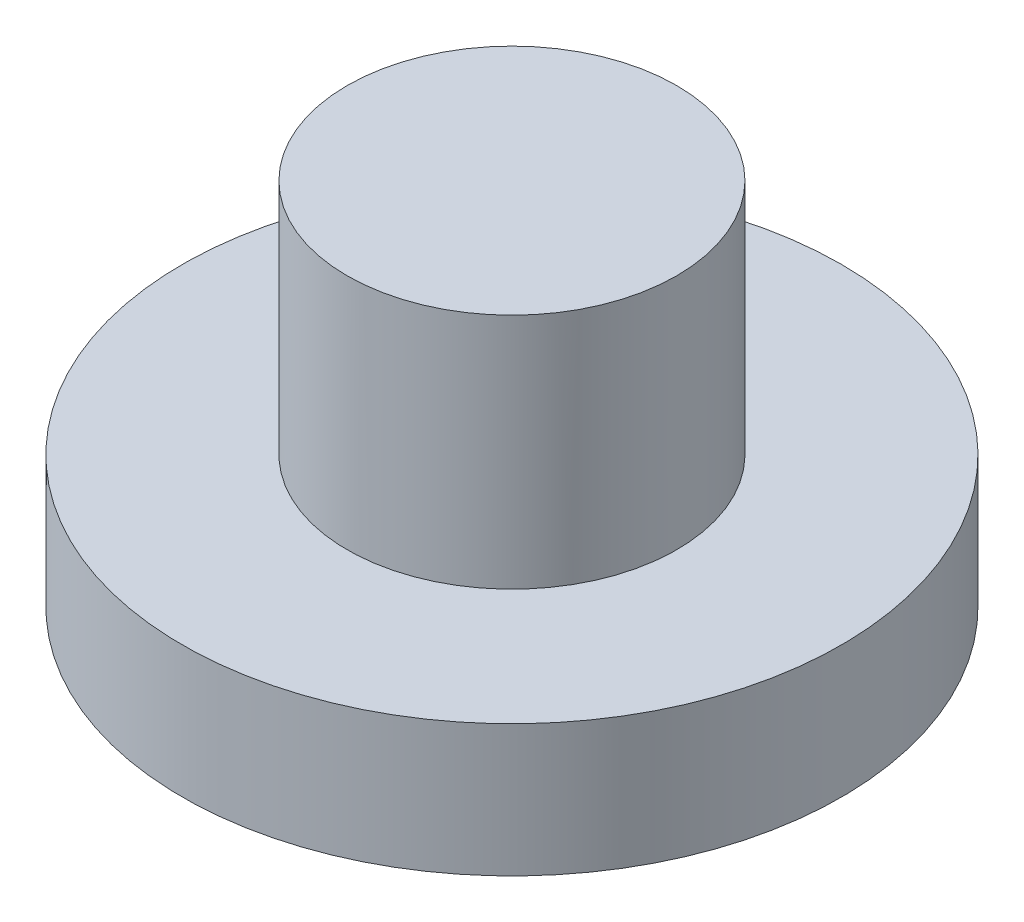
SolidWorks part; units mm, degrees
ref_plane "Front Plane" through (0, 0, 0) normal (0, 0, 1) x (1, 0, 0)
ref_plane "Top Plane" through (0, 0, 0) normal (0, 1, 0) x (1, 0, 0)
ref_plane "Right Plane" through (0, 0, 0) normal (1, 0, 0) x (0, 0, -1)
sketch "Sketch1" plane through (0, 0, 0) normal (0, 1, 0) x (1, 0, 0)
  circle A0 centre (0, 0) radius 0.7938
  dimension "D1" = 1.5875
extrude "Boss-Extrude1" add sketch "Sketch1" along normal blind 1.143
sketch "Sketch2" plane through (0, 0, 0) normal (0, -1, 0) x (1, 0, 0)
  circle A0 centre (0, 0) radius 1.5875
  dimension "D1" = 3.175
extrude "Boss-Extrude2" add sketch "Sketch2" along normal blind 0.635
sketch "Sketch3" plane through (0, 0, 0) normal (1, 0, 0) x (0, 0, -1)
  line L0 (0, 0) -> (0, -1.016) construction
  line L1 (0, -1.016) -> (-0.5307, -1.016) construction
  line L2 (-1.5875, -0.635) -> (1.5875, -0.635) construction
  line L3 (0, -1.016) -> (0, -0.635)
  line L4 (0, -0.635) -> (1.5875, -0.635)
  arc A0 (0, -1.016) -> (1.5875, -0.635) centre (0, 2.4818) ccw
  dimension "D1" = 0.381
revolve "Revolve1" add sketch "Sketch3" angle 360 about L0
